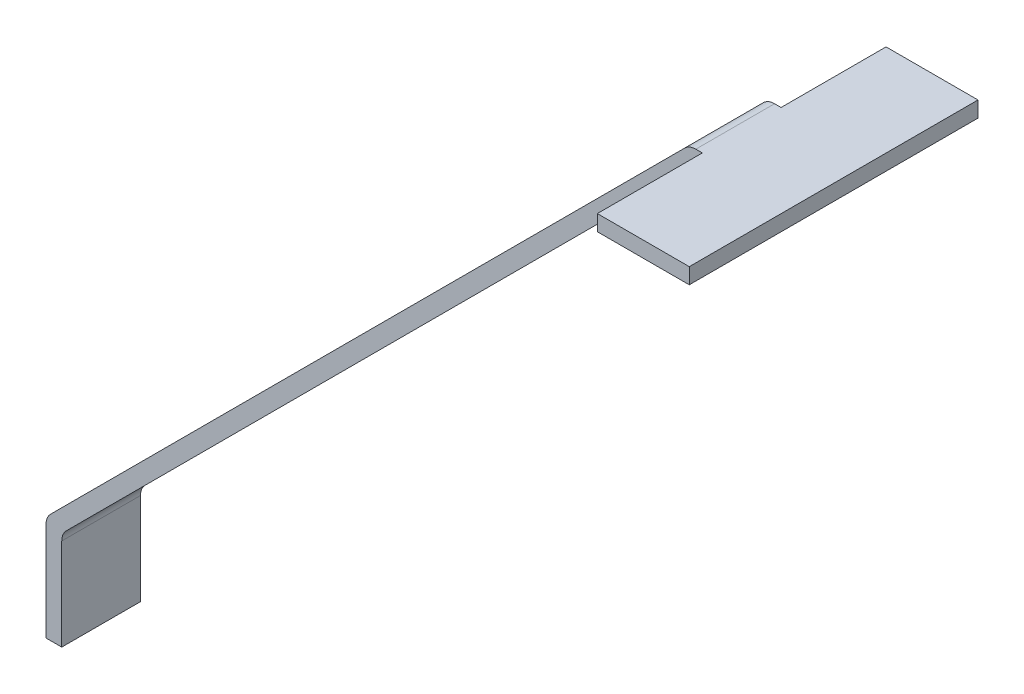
SolidWorks part; units mm, degrees
ref_plane "Front Plane" through (0, 0, 0) normal (0, 0, 1) x (1, 0, 0)
ref_plane "Top Plane" through (0, 0, 0) normal (0, 1, 0) x (1, 0, 0)
ref_plane "Right Plane" through (0, 0, 0) normal (1, 0, 0) x (0, 0, -1)
sketch "Sketch2" plane through (0, 0, 0) normal (0, 0, 1) x (1, 0, 0)
  line L0 (0, 0) -> (122.5416, 122.5416)
  line L1 (122.5416, 122.5416) -> (142.5416, 122.5416)
  line L2 (142.5416, 122.5416) -> (142.5416, 119.5416)
  line L3 (142.5416, 119.5416) -> (123.7842, 119.5416)
  line L4 (123.7842, 119.5416) -> (3, -1.2426)
  line L5 (3, -1.2426) -> (3, -20)
  line L6 (3, -20) -> (0, -20)
  line L7 (0, -20) -> (0, 0)
  dimension "D1" = 3
  dimension "D2" = 3
  dimension "D3" = 3
  dimension "D4" = 20
  dimension "D5" = 135
  dimension "D6" = 173.3
  dimension "D7" = 20
extrude "Boss-Extrude1" add sketch "Sketch2" along normal blind 15
fillet "Fillet3" radius 3 4 edges at (3, -1.2426, 7.5) (0, 0, 7.5) (123.7842, 119.5416, 7.5) (122.5416, 122.5416, 7.5)
sketch "Sketch3" plane through (0, 0, 15) normal (0, 0, 1) x (1, 0, 0)
  line L0 (125.0269, 119.5416) -> (142.5416, 119.5416)
  line L1 (142.5416, 119.5416) -> (142.5416, 122.5416)
  line L2 (142.5416, 122.5416) -> (125.0269, 122.5416)
  line L3 (142.5416, 122.5416) -> (123.7842, 122.5416) construction
  line L4 (125.0269, 122.5416) -> (125.0269, 119.5416)
extrude "Boss-Extrude2" add sketch "Sketch3" along normal blind 20
sketch "Sketch5" plane through (0, 0, 0) normal (0, 0, -1) x (-1, 0, 0)
  line L0 (-125.0269, 119.5416) -> (-142.5416, 119.5416)
  line L1 (-142.5416, 119.5416) -> (-142.5416, 122.5416)
  line L2 (-142.5416, 122.5416) -> (-125.0269, 122.5416)
  line L3 (-142.5416, 122.5416) -> (-123.7842, 122.5416) construction
  line L4 (-125.0269, 122.5416) -> (-125.0269, 119.5416)
extrude "Boss-Extrude3" add sketch "Sketch5" along normal blind 20
